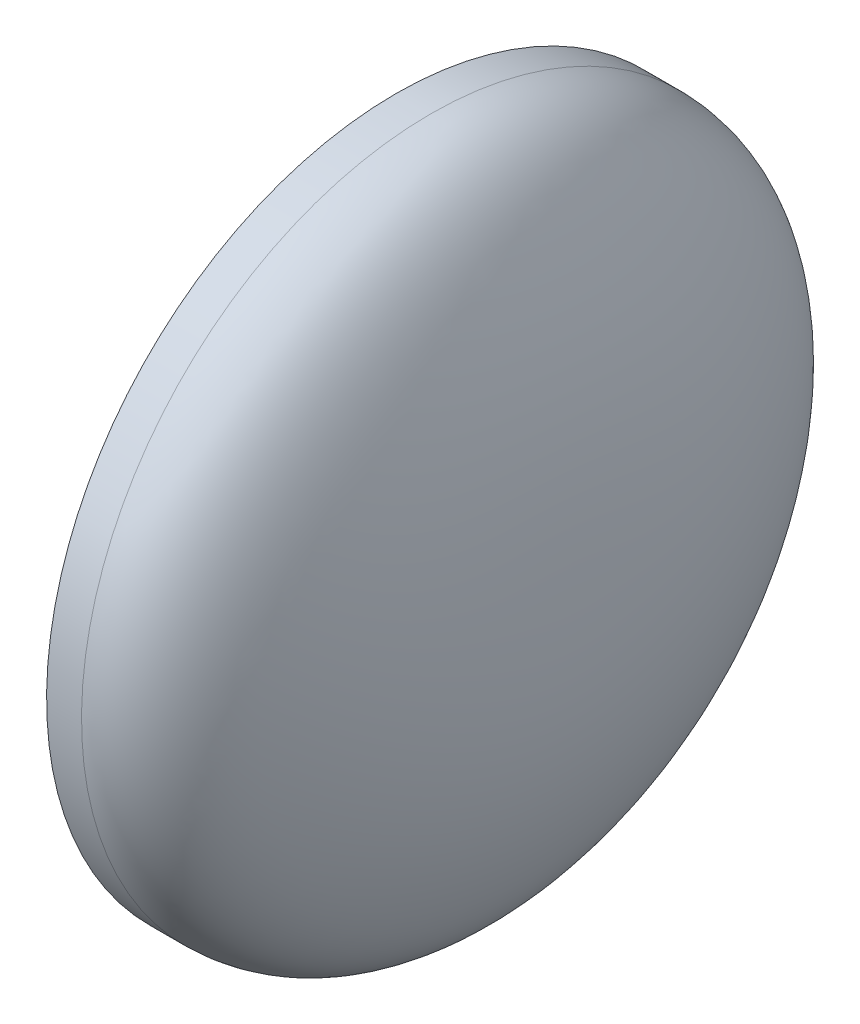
SolidWorks part; units mm, degrees
ref_plane "Спереди" through (0, 0, 0) normal (0, 0, 1) x (1, 0, 0)
ref_plane "Сверху" through (0, 0, 0) normal (0, 1, 0) x (1, 0, 0)
ref_plane "Справа" through (0, 0, 0) normal (1, 0, 0) x (0, 0, -1)
sketch "Эскиз1" plane through (0, 0, 0) normal (0, 0, 1) x (1, 0, 0)
  line L0 (0, 0) -> (0, 5)
  line L1 (0, 5) -> (0.5, 5)
  line L2 (2.5, 0) -> (0, 0)
  line L3 (2.5, -0.4119) -> (2.5, 0.4119) construction
  spline S0 degree 3 poles (0.5, 5) (1.2525, 5) (2.382, 3.0505) (2.5, 1.2761) (2.5, 0) knots 0 0 0 0 0.336054 1 1 1 1
  dimension "D1" = 5
  dimension "D2" = 2.5
  dimension "D3" = 0.5
revolve "Повернуть1" add sketch "Эскиз1" angle 360 about L2
